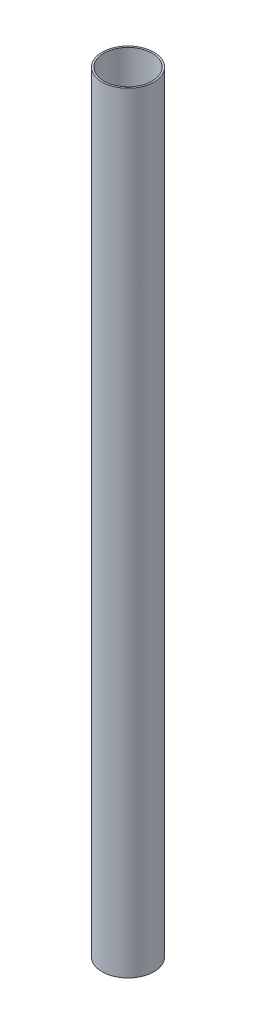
SolidWorks part; units mm, degrees
ref_plane "Face" through (0, 0, 0) normal (0, 0, 1) x (1, 0, 0)
ref_plane "Dessus" through (0, 0, 0) normal (0, 1, 0) x (1, 0, 0)
ref_plane "Droite" through (0, 0, 0) normal (1, 0, 0) x (0, 0, -1)
sketch "Esquisse1" plane through (0, 0, 0) normal (0, 1, 0) x (1, 0, 0)
  circle A0 centre (0, 0) radius 30
  circle A1 centre (0, 0) radius 28
  dimension "D1" = 60
  dimension "D2" = 56
extrude "Base-Extrusion" add sketch "Esquisse1" along normal blind 870 and the other way blind 23
sketch "Esquisse2" plane through (0, 0, 0) normal (1, 0, 0) x (0, 0, -1)
  line L0 (-23, -30) -> (-23, 5)
  line L1 (-23, -30) -> (23, -30)
  line L2 (23, -30) -> (23, 5)
  arc A0 (-23, 5) -> (23, 5) centre (0, 5) cw
  dimension "D1" = 23
  dimension "D2" = 5
  dimension "D3" = 46
extrude "Enlèv. mat.-Extru.1" cut sketch "Esquisse2" against normal through all
sketch "Esquisse3" plane through (0, 0, 0) normal (1, 0, 0) x (0, 0, -1)
  line L0 (0, 870) -> (0, -23) construction
  circle A0 centre (0, 47.5) radius 5
  circle A1 centre (0, 107.5) radius 5
  dimension "D2" = 10
  dimension "D3" = 10
  dimension "D1" = 60
  dimension "D4" = 107.5
extrude "Enlèv. mat.-Extru.4" cut sketch "Esquisse3" against normal through all
